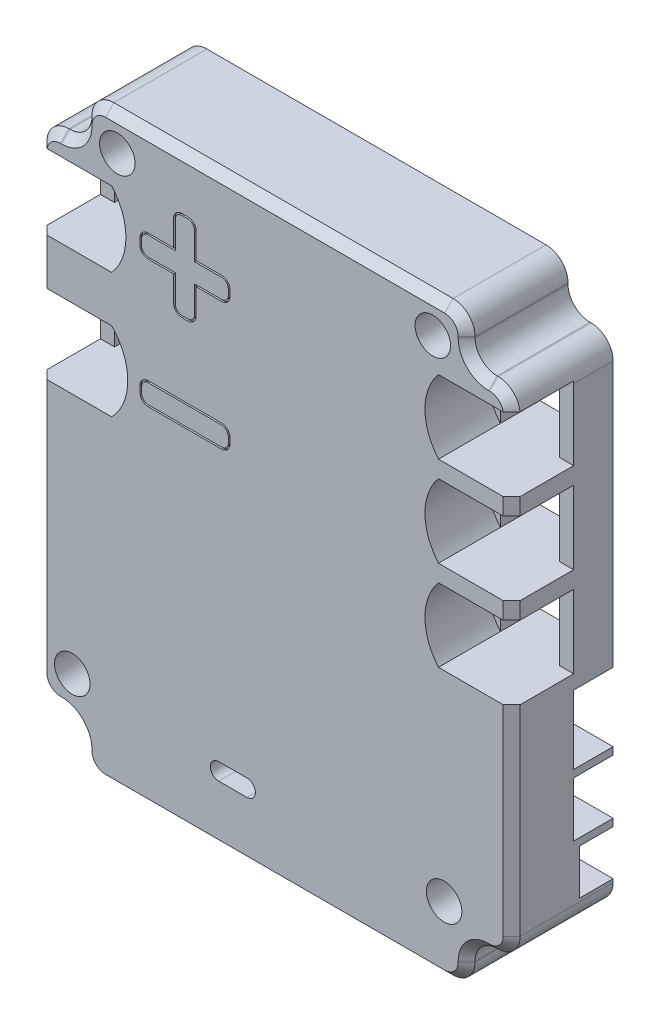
SolidWorks part; units mm, degrees
ref_plane "前视基准面" through (0, 0, 0) normal (0, 0, 1) x (1, 0, 0)
ref_plane "上视基准面" through (0, 0, 0) normal (0, 1, 0) x (1, 0, 0)
ref_plane "右视基准面" through (0, 0, 0) normal (1, 0, 0) x (0, 0, -1)
other "Configuration Table"
sketch "草图1" plane through (0, 0, 0) normal (0, 0, 1) x (1, 0, 0)
  line L0 (6, 1.9) -> (6, 2.1)
  line L1 (0, 0) -> (80, 0) construction
  line L2 (0, 0) -> (0, 100) construction
  line L3 (0, 100) -> (80, 100) construction
  line L4 (80, 0) -> (80, 100) construction
  line L5 (9.9, -2) -> (70.1, -2)
  line L6 (-2, 9.9) -> (-2, 90.1)
  line L7 (9.9, 102) -> (70.1, 102)
  line L8 (82, 9.9) -> (82, 90.1)
  line L9 (1.9, 94) -> (2.1, 94)
  line L10 (74, 1.9) -> (74, 2.1)
  line L11 (1.9, 6) -> (2.1, 6)
  line L12 (6, 94) -> (74, 94) construction
  line L13 (6, 6) -> (6, 94) construction
  line L14 (74, 6) -> (74, 94) construction
  line L15 (6, 6) -> (74, 6) construction
  line L16 (-2, 102) -> (82, 102) construction
  line L17 (-2, -2) -> (-2, 102) construction
  line L18 (77.9, 94) -> (78.1, 94)
  line L19 (6, 97.9) -> (6, 98.1)
  line L20 (82, -2) -> (82, 102) construction
  line L21 (-2, -2) -> (82, -2) construction
  line L22 (77.9, 6) -> (78.1, 6)
  line L23 (74, 97.9) -> (74, 98.1)
  arc A0 (-2, 9.9) -> (1.9, 6) centre (1.9, 9.9) ccw
  arc A1 (2.1, 6) -> (6, 2.1) centre (2.1, 2.1) cw
  arc A2 (6, 1.9) -> (9.9, -2) centre (9.9, 1.9) ccw
  arc A3 (70.1, -2) -> (74, 1.9) centre (70.1, 1.9) ccw
  arc A4 (74, 2.1) -> (77.9, 6) centre (77.9, 2.1) cw
  arc A5 (78.1, 6) -> (82, 9.9) centre (78.1, 9.9) ccw
  arc A6 (82, 90.1) -> (78.1, 94) centre (78.1, 90.1) ccw
  arc A7 (77.9, 94) -> (74, 97.9) centre (77.9, 97.9) cw
  arc A8 (74, 98.1) -> (70.1, 102) centre (70.1, 98.1) ccw
  arc A9 (-2, 90.1) -> (1.9, 94) centre (1.9, 90.1) cw
  arc A10 (2.1, 94) -> (6, 97.9) centre (2.1, 97.9) ccw
  arc A11 (6, 98.1) -> (9.9, 102) centre (9.9, 98.1) cw
  point P41 (74, 94)
  point P48 (6, 94)
  dimension "D8" = 3.9
  dimension "D1" = 100
  dimension "D2" = 80
  dimension "D3" = 2
  dimension "D4" = 2
  dimension "D5" = 2
  dimension "D6" = 2
  dimension "D7" = 8
extrude "凸台-拉伸1" add sketch "草图1" along normal blind 18
sketch "草图2" plane through (0, 0, 0) normal (0, 0, -1) x (-1, 0, 0)
  line L0 (-82, 9.9) -> (-82, 90.1) construction
  line L1 (-68.1, 100) -> (-11.9, 100)
  line L2 (-80, 88.1) -> (-80, 11.9)
  line L3 (-68.1, 0) -> (-11.9, 0)
  line L4 (0, 88.1) -> (0, 11.9)
  line L5 (2, 90.1) -> (2, 9.9) construction
  line L6 (-70.1, 102) -> (-9.9, 102) construction
  line L7 (-9.9, -2) -> (-70.1, -2) construction
  line L8 (-72, 96.1) -> (-72, 95.9)
  line L9 (-76.1, 8) -> (-75.9, 8)
  line L10 (-8, 96.1) -> (-8, 95.9)
  line L11 (-76.1, 92) -> (-75.9, 92)
  line L12 (-72, 92) -> (-8, 92) construction
  line L13 (-72, 92) -> (-72, 8) construction
  line L14 (-8, 92) -> (-8, 8) construction
  line L15 (-72, 8) -> (-8, 8) construction
  line L16 (-80, 100) -> (0, 100) construction
  line L17 (-80, 100) -> (-80, 0) construction
  line L18 (0, 100) -> (0, 0) construction
  line L19 (-80, 0) -> (0, 0) construction
  line L20 (-72, 4.1) -> (-72, 3.9)
  line L21 (-4.1, 92) -> (-3.9, 92)
  line L22 (-8, 4.1) -> (-8, 3.9)
  line L23 (-4.1, 8) -> (-3.9, 8)
  arc A0 (-80, 11.9) -> (-76.1, 8) centre (-76.1, 11.9) ccw
  arc A1 (-72, 4.1) -> (-75.9, 8) centre (-75.9, 4.1) ccw
  arc A2 (-72, 3.9) -> (-68.1, 0) centre (-68.1, 3.9) ccw
  arc A3 (-11.9, 0) -> (-8, 3.9) centre (-11.9, 3.9) ccw
  arc A4 (-8, 4.1) -> (-4.1, 8) centre (-4.1, 4.1) cw
  arc A5 (-3.9, 8) -> (0, 11.9) centre (-3.9, 11.9) ccw
  arc A6 (0, 88.1) -> (-3.9, 92) centre (-3.9, 88.1) ccw
  arc A7 (-4.1, 92) -> (-8, 95.9) centre (-4.1, 95.9) cw
  arc A8 (-8, 96.1) -> (-11.9, 100) centre (-11.9, 96.1) ccw
  arc A9 (-80, 88.1) -> (-76.1, 92) centre (-76.1, 88.1) cw
  arc A10 (-75.9, 92) -> (-72, 95.9) centre (-75.9, 95.9) ccw
  arc A11 (-72, 96.1) -> (-68.1, 100) centre (-68.1, 96.1) cw
  point P38 (-8, 8)
  dimension "D6" = 3.9
  dimension "D1" = 2
  dimension "D2" = 2
  dimension "D3" = 2
  dimension "D4" = 2
  dimension "D5" = 8
extrude "切除-拉伸1" cut sketch "草图2" against normal blind 16
sketch "草图6" plane through (0, 0, 0) normal (0, 0, -1) x (-1, 0, 0)
  line L0 (-80, 88.1) -> (-80, 11.9) construction
  line L1 (-80, 93.1) -> (-67, 93.1)
  line L2 (-80, 93.1) -> (-80, 7.435)
  line L3 (-80, 7.435) -> (-72.5, 7.435)
  line L4 (-67, 93.1) -> (-67, 14.316)
  line L5 (-70.1, 102) -> (-9.9, 102) construction
  line L8 (-67, 14.316) -> (-67, 7.435)
  line L9 (-67, 7.435) -> (-72.5, 7.435)
  dimension "D1" = 8.9
  dimension "D2" = 13
extrude "凸台-拉伸5" add sketch "草图6" against normal up to surface (16 mm away)
sketch "草图8" plane through (0, 0, 0) normal (0, 0, -1) x (-1, 0, 0)
  line L0 (-82, 9.9) -> (-82, 90.1) construction
  line L1 (-82, 90.5) -> (-69, 90.5)
  line L2 (-82, 90.5) -> (-82, 77.5)
  line L3 (-82, 77.5) -> (-69, 77.5)
  line L4 (-69, 90.5) -> (-69, 77.5)
  line L6 (-11.9, 100) -> (-68.1, 100) construction
  line L7 (-82, 74.5) -> (-69, 74.5)
  line L8 (-82, 74.5) -> (-82, 61.5)
  line L9 (-82, 61.5) -> (-69, 61.5)
  line L10 (-69, 74.5) -> (-69, 61.5)
  line L11 (-82, 58.5) -> (-69, 58.5)
  line L12 (-82, 58.5) -> (-82, 45.5)
  line L13 (-82, 45.5) -> (-69, 45.5)
  line L14 (-69, 58.5) -> (-69, 45.5)
  line L15 (-11.9, 100) -> (-68.1, 100) construction
  dimension "D1" = 9.5
  dimension "D2" = 13
  dimension "D3" = 25.5
  dimension "D4" = 13
  dimension "D5" = 41.5
  dimension "D6" = 13
  dimension "D7" = 13
  dimension "D8" = 13
  dimension "D9" = 13
extrude "切除-拉伸3" cut sketch "草图8" against normal through all
sketch "草图9" plane through (0, 0, 0) normal (0, 0, -1) x (-1, 0, 0)
  line L0 (-82, 9.9) -> (-82, 45.5) construction
  line L5 (-68.1, 0) -> (-11.9, 0) construction
  line L10 (-82, 18.5) -> (-73.5, 18.5)
  line L11 (-82, 18.5) -> (-82, 10.5)
  line L12 (-82, 10.5) -> (-73.5, 10.5)
  line L13 (-73.5, 18.5) -> (-73.5, 10.5)
  dimension "D1" = 10.5
  dimension "D2" = 18.5
  dimension "D3" = 8.5
extrude "切除-拉伸4" cut sketch "草图9" against normal blind 3.5
sketch "草图10" plane through (0, 0, 0) normal (0, 0, -1) x (-1, 0, 0)
  line L0 (-82, 18.5) -> (-82, 45.5) construction
  line L1 (-82, 43) -> (-75, 43)
  line L2 (-82, 43) -> (-82, 30.8)
  line L3 (-82, 30.8) -> (-75, 30.8)
  line L4 (-75, 43) -> (-75, 30.8)
  line L5 (-68.1, 0) -> (-11.9, 0) construction
  line L6 (-82, 29.5) -> (-75, 29.5)
  line L7 (-82, 29.5) -> (-82, 19.8)
  line L8 (-82, 19.8) -> (-75, 19.8)
  line L9 (-75, 29.5) -> (-75, 19.8)
  line L10 (-68.1, 0) -> (-11.9, 0) construction
  dimension "D1" = 19.8
  dimension "D2" = 29.5
  dimension "D3" = 7
  dimension "D4" = 30.8
  dimension "D5" = 43
  dimension "D6" = 7
extrude "切除-拉伸5" cut sketch "草图10" against normal blind 4.5
sketch "草图11" plane through (0, 0, 0) normal (0, 0, -1) x (-1, 0, 0)
  line L1 (-73, 22) -> (-64.6031, 22)
  line L4 (-64.6031, 22) -> (-64.6031, 30.5)
  line L5 (-68.1, 0) -> (-11.9, 0) construction
  line L7 (0, 11.9) -> (0, 88.1) construction
  line L14 (-70, 44.5) -> (-66.0552, 44.5)
  line L18 (-66.0552, 44.5) -> (-64.6031, 44.5)
  line L19 (-64.6031, 44.5) -> (-64.6031, 30.5)
  line L20 (-73, 41.5) -> (-73, 22)
  arc A0 (-70, 44.5) -> (-73, 41.5) centre (-70, 41.5) ccw
  dimension "D8" = 6
  dimension "D2" = 22
  dimension "D6" = 70
  dimension "D7" = 41.5
extrude "切除-拉伸6" cut sketch "草图11" against normal up to surface (16 mm away)
sketch "草图13" plane through (0, 0, 18) normal (0, 0, 1) x (1, 0, 0)
  line L0 (82, 45.5) -> (69, 45.5) construction
  line L1 (81.8544, 91.1556) -> (79.5, 91.1556)
  line L2 (82, 90.1) -> (82, 45.5)
  line L3 (82, 45.5) -> (79.5, 45.5)
  line L4 (79.5, 91.1556) -> (79.5, 45.5)
  arc A0 (82, 90.1) -> (81.8544, 91.1556) centre (78.1, 90.1) ccw
  dimension "D1" = 2.5
extrude "凸台-拉伸6" add sketch "草图13" against normal up to surface (18 mm away)
sketch "草图14" plane through (0, 0, 18) normal (0, 0, 1) x (1, 0, 0)
  line L0 (82, 9.9) -> (82, 90.1) construction
  line L1 (79.5, 90.5) -> (82, 90.5)
  line L2 (79.5, 90.5) -> (79.5, 77.5)
  line L3 (79.5, 77.5) -> (82, 77.5)
  line L4 (82, 90.5) -> (82, 77.5)
  line L6 (79.5, 74.5) -> (82, 74.5)
  line L7 (79.5, 74.5) -> (79.5, 61.5)
  line L8 (79.5, 61.5) -> (82, 61.5)
  line L9 (82, 74.5) -> (82, 61.5)
  line L10 (79.5, 58.5) -> (82, 58.5)
  line L11 (79.5, 58.5) -> (79.5, 45.5)
  line L12 (79.5, 45.5) -> (82, 45.5)
  line L13 (82, 58.5) -> (82, 45.5)
  dimension "D1" = 13
  dimension "D2" = 13
  dimension "D3" = 13
extrude "切除-拉伸8" cut sketch "草图14" against normal blind 11
sketch "草图16" plane through (0, 0, 0) normal (0, 0, -1) x (-1, 0, 0)
  line L0 (0, 11.9) -> (0, 88.1) construction
  line L2 (-16.5, 93.2144) -> (-16.5, 14.2455)
  line L3 (-16.5, 14.2455) -> (0, 14.2455)
  line L4 (0, 93.2144) -> (0, 14.2455)
  line L5 (2, 90.1) -> (2, 9.9) construction
  line L8 (0, 93.2144) -> (-16.5, 93.2144)
  dimension "D1" = 18.5
extrude "凸台-拉伸7" add sketch "草图16" against normal up to surface (16 mm away)
sketch "草图17" plane through (0, 0, 0) normal (0, 0, -1) x (-1, 0, 0)
  line L0 (-11.9, 100) -> (-68.1, 100) construction
  line L1 (-0.5, 90.5) -> (-11, 90.5)
  line L2 (-0.5, 90.5) -> (-0.5, 77.2)
  line L3 (-0.5, 77.2) -> (-11, 77.2)
  line L4 (-11, 90.5) -> (-11, 77.2)
  line L5 (-0.5, 69) -> (-11, 69)
  line L6 (-0.5, 69) -> (-0.5, 55)
  line L7 (-0.5, 55) -> (-11, 55)
  line L8 (-11, 69) -> (-11, 55)
  line L9 (-11.9, 100) -> (-68.1, 100) construction
  line L10 (2, 90.1) -> (2, 9.9) construction
  dimension "D1" = 9.5
  dimension "D2" = 22.8
  dimension "D3" = 2.5
  dimension "D4" = 10.5
  dimension "D5" = 2.5
  dimension "D6" = 10.5
  dimension "D7" = 31
  dimension "D8" = 45
extrude "切除-拉伸9" cut sketch "草图17" against normal through all
sketch "草图18" plane through (0, 0, 18) normal (0, 0, 1) x (1, 0, 0)
  line L0 (-2, 90.1) -> (-2, 9.9) construction
  line L1 (0.5, 90.5) -> (-2, 90.5)
  line L2 (0.5, 90.5) -> (0.5, 77.2)
  line L3 (0.5, 77.2) -> (-2, 77.2)
  line L4 (-2, 90.5) -> (-2, 77.2)
  line L5 (0.5, 55) -> (0.5, 69) construction
  line L6 (0.5, 69) -> (-2, 69)
  line L7 (0.5, 69) -> (0.5, 55)
  line L8 (0.5, 55) -> (-2, 55)
  line L9 (-2, 69) -> (-2, 55)
  dimension "D1" = 13.3
  dimension "D2" = 14
extrude "切除-拉伸10" cut sketch "草图18" against normal up to surface (11 mm away)
sketch "草图22" plane through (0, 0, 0) normal (0, 0, -1) x (-1, 0, 0)
  line L0 (2, 90.1) -> (2, 9.9) construction
  line L1 (2, 49) -> (-16.5, 49)
  line L2 (2, 49) -> (2, 32.3)
  line L3 (2, 32.3) -> (-16.5, 32.3)
  line L4 (-16.5, 49) -> (-16.5, 32.3)
  line L7 (2, 31) -> (-16.5, 31)
  line L8 (2, 31) -> (2, 14.2455)
  line L9 (2, 14.2455) -> (-16.5, 14.2455)
  line L10 (-16.5, 31) -> (-16.5, 14.2455)
  line L11 (-68.1, 0) -> (-11.9, 0) construction
  line L12 (-68.1, 0) -> (-11.9, 0) construction
  dimension "D2" = 31
  dimension "D3" = 32.3
  dimension "D4" = 49
extrude "切除-拉伸16" cut sketch "草图22" against normal blind 8.7
sketch "草图23" plane through (0, 0, 0) normal (0, 0, -1) x (-1, 0, 0)
  line L4 (-73.9847, 6.0466) -> (-70.3945, -0.8347)
  line L5 (-70.3945, -0.8347) -> (-68.9263, -1.64)
  line L6 (-68.9263, -1.64) -> (-8.8752, -1.64)
  line L7 (-8.8752, -1.64) -> (-7.5895, 0.704)
  line L8 (-7.5895, 0.704) -> (-6.1243, 3.3751)
  line L19 (-16.5, 7) -> (-65.5, 7)
  line L20 (-9.9, -2) -> (-70.1, -2) construction
  line L21 (-16.5, 7) -> (-16.5, 14.2455)
  line L26 (-16.5, 14.2455) -> (-6.8189, 14.2455)
  line L27 (-73.9847, 7.347) -> (-73.9847, 6.0466)
  line L29 (-73.9847, 7.347) -> (-73.9742, 7.3333)
  line L30 (-73.9742, 7.3333) -> (-72.4075, 11.5635)
  line L31 (-72.4075, 11.5635) -> (-70.51, 14.5577)
  line L33 (0, 14.2455) -> (-16.5, 14.2455) construction
  line L34 (-6.8189, 14.2455) -> (1.2926, 14.2455)
  line L35 (1.2926, 14.2455) -> (1.2926, 11.043)
  line L36 (1.2926, 11.043) -> (-0.5888, 7.5907)
  line L37 (-0.5888, 7.5907) -> (-4.9543, 6.1112)
  line L38 (-4.9543, 6.1112) -> (-6.1243, 3.3751)
  line L40 (-70.51, 14.5577) -> (-67, 22)
  line L41 (-67, 22) -> (-65.5, 22)
  line L42 (-65.5, 22) -> (-65.5, 7)
  dimension "D1" = 9
  dimension "D2" = 1.5
extrude "凸台-拉伸8" add sketch "草图23" against normal up to surface (16 mm away)
sketch "草图24" plane through (0, 0, 0) normal (0, 0, -1) x (-1, 0, 0)
  line L0 (-9.9, -2) -> (-70.1, -2) construction
  line L1 (-69.5, -2) -> (-10.5, -2)
  line L2 (-69.5, -2) -> (-69.5, 5.5)
  line L3 (-69.5, 5.5) -> (-10.5, 5.5)
  line L4 (-10.5, -2) -> (-10.5, 5.5)
  line L5 (2, 14.2455) -> (2, 9.9) construction
  line L6 (-82, 18.5) -> (-82, 10.5) construction
  dimension "D1" = 7.5
  dimension "D2" = 12.5
  dimension "D3" = 12.5
extrude "切除-拉伸17" cut sketch "草图24" against normal blind 4.5
sketch "草图25" plane through (0, 0, 0) normal (0, 0, -1) x (-1, 0, 0)
  line L0 (-69.5, -2) -> (-10.5, -2) construction
  line L1 (-29.6, 8.2) -> (-20.4, 8.2)
  line L2 (-29.6, 8.2) -> (-29.6, -2)
  line L3 (-29.6, -2) -> (-20.4, -2)
  line L4 (-20.4, 8.2) -> (-20.4, -2)
  dimension "D1" = 10.2
  dimension "D2" = 20.4
  dimension "D3" = 9.2
extrude "切除-拉伸18" cut sketch "草图25" against normal blind 3
sketch "草图26" plane through (0, 0, 0) normal (0, 0, -1) x (-1, 0, 0)
  line L1 (-20.9012, 15.117) -> (-10.6829, 15.117)
  line L2 (-20.9012, 15.117) -> (-20.9012, 6.1419)
  line L3 (-20.9012, 6.1419) -> (-10.6829, 6.1419)
  line L4 (-10.6829, 15.117) -> (-10.6829, 6.1419)
extrude "切除-拉伸19" cut sketch "草图26" against normal up to surface (3 mm away)
sketch "草图30" plane through (0, 0, 18) normal (0, 0, 1) x (1, 0, 0)
  line L0 (30, 10) -> (35, 10) construction
  line L1 (30, 11.5) -> (35, 11.5)
  line L2 (30, 8.5) -> (35, 8.5)
  line L3 (-2, 55) -> (-2, 9.9) construction
  line L4 (9.9, -2) -> (70.1, -2) construction
  arc A0 (30, 11.5) -> (30, 8.5) centre (30, 10) ccw
  arc A1 (35, 8.5) -> (35, 11.5) centre (35, 10) ccw
  point P2 (32.5, 10)
  dimension "D1" = 32
  dimension "D2" = 5
  dimension "D3" = 3
  dimension "D4" = 12
extrude "切除-拉伸21" cut sketch "草图30" against normal up to surface (2 mm away)
fillet "圆角1" radius 2.5 2 edges at (6.928, 93.2144, 8) (73.1852, 93.1, 8)
sketch "草图37" plane through (0, 0, 0) normal (0, 0, -1) x (-1, 0, 0)
  line L0 (2, 49) -> (-16.5, 49) construction
  line L1 (-16.5, 93.2144) -> (-12.5, 93.2144)
  line L2 (-16.5, 93.2144) -> (-16.5, 49)
  line L3 (-16.5, 49) -> (-11, 49)
  line L4 (-12.5, 93.2144) -> (-12.5, 76.2)
  line L5 (-11, 90.5) -> (-11, 77.2) construction
  line L6 (-11, 77.2) -> (-0.5, 77.2) construction
  line L7 (-12.5, 76.2) -> (0, 76.2)
  line L9 (-12.5, 70) -> (0, 70)
  line L10 (0, 76.2) -> (0, 70)
  line L11 (-0.5, 69) -> (-11, 69) construction
  line L12 (-11, 55) -> (-0.5, 55) construction
  line L13 (-11, 49) -> (0, 49)
  line L15 (-12.5, 54) -> (0, 54)
  line L16 (0, 49) -> (0, 54)
  line L17 (2, 90.1) -> (2, 49) construction
  line L18 (-12.5, 70) -> (-12.5, 54)
  dimension "D1" = 1.5
  dimension "D2" = 1
  dimension "D3" = 1
  dimension "D4" = 2
  dimension "D5" = 1
  dimension "D6" = 2
extrude "切除-拉伸27" cut sketch "草图37" against normal up to surface (8.7 mm away)
sketch "草图43" plane through (0, 0, 0) normal (0, 0, -1) x (-1, 0, 0)
  line L0 (0, 54) -> (-12.5, 54) construction
  line L1 (-65.3531, 94.8255) -> (-69, 94.8255)
  line L2 (-65.3531, 94.8255) -> (-65.3531, 43.8321)
  line L3 (-65.3531, 43.8321) -> (-69, 43.8321)
  line L4 (-69, 94.8255) -> (-69, 43.8321)
  line L5 (-12.5, 93.2144) -> (-11, 93.2144)
  line L6 (-12.5, 93.2144) -> (-12.5, 54)
  line L7 (-12.5, 54) -> (-11, 54)
  line L8 (-11, 93.2144) -> (-11, 54)
extrude "切除-拉伸31" cut sketch "草图43" against normal blind 2
sketch "草图44" plane through (0, 0, 16) normal (0, 0, -1) x (-1, 0, 0)
  line L0 (-34, 92) -> (-34, 58) construction
  line L1 (-26.5, 92) -> (-26.5, 58)
  line L2 (-41.5, 92) -> (-41.5, 58)
  line L5 (-70.1, 102) -> (-9.9, 102) construction
  line L6 (2, 90.1) -> (2, 49) construction
  arc A0 (-26.5, 92) -> (-41.5, 92) centre (-34, 92) ccw
  arc A1 (-41.5, 58) -> (-26.5, 58) centre (-34, 58) ccw
  point P2 (-34, 75)
  dimension "D4" = 7.5
  dimension "D1" = 36
  dimension "D2" = 10
  dimension "D3" = 34
extrude "切除-拉伸32" cut sketch "草图44" against normal blind 1
chamfer "倒角2" distance 1.5 angle 45 27 edges at (82, 27.7, 18) (80.8577, 7.1423, 18) (78, 6, 18) (75.1423, 4.8577, 18) (74, 2, 18) (72.8577, -0.8577, 18) (40, -2, 18) (7.1423, -0.8577, 18) (6, 2, 18) (4.8577, 4.8577, 18) (2, 6, 18) (-0.8577, 7.1423, 18) (-2, 32.45, 18) (-2, 73.1, 18) (-0.7125, 92.9957, 18) (2, 94, 18) (4.8577, 95.1423, 18) (6, 98, 18) (7.1423, 100.8577, 18) (40, 102, 18) (72.8577, 100.8577, 18) (74, 98, 18) (75.1423, 95.1423, 18) (78, 94, 18) (80.7125, 92.9957, 18) (82, 60, 18) (82, 76, 18)
sketch "草图45" plane through (0, 0, 18) normal (0, 0, 1) x (1, 0, 0)
  line L0 (-2, 77.2) -> (-2, 90.1) construction
  line L1 (17.5, 86.5) -> (22, 86.5)
  line L2 (16, 85) -> (16, 84)
  line L3 (17.5, 82.5) -> (22, 82.5)
  line L4 (32, 85) -> (32, 84)
  line L5 (23.5, 92.5) -> (24.5, 92.5)
  line L6 (22, 91) -> (22, 86.5)
  line L7 (23.5, 76.5) -> (24.5, 76.5)
  line L8 (26, 91) -> (26, 86.5)
  line L9 (9.9, 102) -> (70.1, 102) construction
  line L10 (26, 86.5) -> (30.5, 86.5)
  line L11 (22, 82.5) -> (22, 78)
  line L12 (26, 82.5) -> (26, 78)
  line L13 (26, 82.5) -> (30.5, 82.5)
  line L14 (-2, 55) -> (-2, 69) construction
  line L15 (17.5, 63.8) -> (30.5, 63.8)
  line L16 (16, 62.3) -> (16, 61.3)
  line L17 (17.5, 59.8) -> (30.5, 59.8)
  line L18 (32, 62.3) -> (32, 61.3)
  line L19 (22.3, 91) -> (22.3, 86.2)
  line L20 (17.5, 86.2) -> (22.3, 86.2)
  line L21 (16.3, 85) -> (16.3, 84)
  line L22 (17.5, 82.8) -> (22.3, 82.8)
  line L23 (22.3, 82.8) -> (22.3, 78)
  line L24 (23.5, 76.8) -> (24.5, 76.8)
  line L25 (25.7, 82.8) -> (25.7, 78)
  line L26 (25.7, 82.8) -> (30.5, 82.8)
  line L27 (31.7, 85) -> (31.7, 84)
  line L28 (25.7, 86.2) -> (30.5, 86.2)
  line L29 (25.7, 91) -> (25.7, 86.2)
  line L30 (23.5, 92.2) -> (24.5, 92.2)
  line L31 (17.5, 63.5) -> (30.5, 63.5)
  line L32 (31.7, 62.3) -> (31.7, 61.3)
  line L33 (17.5, 60.1) -> (30.5, 60.1)
  line L34 (16.3, 62.3) -> (16.3, 61.3)
  arc A0 (30.5, 63.8) -> (32, 62.3) centre (30.5, 62.3) cw
  arc A1 (32, 61.3) -> (30.5, 59.8) centre (30.5, 61.3) cw
  arc A2 (17.5, 59.8) -> (16, 61.3) centre (17.5, 61.3) cw
  arc A3 (16, 62.3) -> (17.5, 63.8) centre (17.5, 62.3) cw
  arc A4 (17.5, 86.5) -> (16, 85) centre (17.5, 85) ccw
  arc A5 (16, 84) -> (17.5, 82.5) centre (17.5, 84) ccw
  arc A6 (23.5, 76.5) -> (22, 78) centre (23.5, 78) cw
  arc A7 (24.5, 76.5) -> (26, 78) centre (24.5, 78) ccw
  arc A8 (30.5, 82.5) -> (32, 84) centre (30.5, 84) ccw
  arc A9 (32, 85) -> (30.5, 86.5) centre (30.5, 85) ccw
  arc A10 (26, 91) -> (24.5, 92.5) centre (24.5, 91) ccw
  arc A11 (22, 91) -> (23.5, 92.5) centre (23.5, 91) cw
  arc A12 (17.5, 86.2) -> (16.3, 85) centre (17.5, 85) ccw
  arc A13 (16.3, 84) -> (17.5, 82.8) centre (17.5, 84) ccw
  arc A14 (23.5, 76.8) -> (22.3, 78) centre (23.5, 78) cw
  arc A15 (24.5, 76.8) -> (25.7, 78) centre (24.5, 78) ccw
  arc A16 (30.5, 82.8) -> (31.7, 84) centre (30.5, 84) ccw
  arc A17 (31.7, 85) -> (30.5, 86.2) centre (30.5, 85) ccw
  arc A18 (25.7, 91) -> (24.5, 92.2) centre (24.5, 91) ccw
  arc A19 (22.3, 91) -> (23.5, 92.2) centre (23.5, 91) cw
  arc A20 (30.5, 63.5) -> (31.7, 62.3) centre (30.5, 62.3) cw
  arc A21 (31.7, 61.3) -> (30.5, 60.1) centre (30.5, 61.3) cw
  arc A22 (17.5, 60.1) -> (16.3, 61.3) centre (17.5, 61.3) cw
  arc A23 (16.3, 62.3) -> (17.5, 63.5) centre (17.5, 62.3) cw
  point P24 (32, 63.8)
  point P27 (32, 59.8)
  point P32 (16, 63.8)
  point P35 (16, 86.5)
  point P42 (26, 76.5)
  point P45 (32, 82.5)
  point P48 (32, 86.5)
  point P51 (26, 92.5)
  point P54 (22, 92.5)
  dimension "D13" = 1.5
  dimension "D1" = 16
  dimension "D2" = 4
  dimension "D3" = 4
  dimension "D4" = 16
  dimension "D5" = 18
  dimension "D6" = 6
  dimension "D7" = 6
  dimension "D8" = 9.5
  dimension "D9" = 16
  dimension "D10" = 4
  dimension "D11" = 38.2
  dimension "D12" = 18
  dimension "D14" = 0.3
sketch "草图48" plane through (0, 0, 16) normal (0, 0, -1) x (-1, 0, 0)
  line L0 (-64.5, 100) -> (-64.5, 93.1)
  line L1 (-11.9, 100) -> (-68.1, 100) construction
  line L2 (-82, 43) -> (-82, 90.1) construction
  line L4 (-64.5, 100) -> (-68.1, 100)
  line L5 (-15.5, 100) -> (-15.5, 93.4252)
  line L6 (-11.9, 100) -> (-68.1, 100) construction
  line L8 (2, 90.1) -> (2, 49) construction
  line L9 (-15.5, 100) -> (-11.9, 100)
  line L10 (-69.507, 93.1) -> (-69.507, 92.1)
  line L11 (-69.507, 92.1) -> (-64.5, 92.1)
  line L12 (-64.5, 92.1) -> (-64.5, 93.1)
  line L13 (-15.5, 93.4252) -> (-15.5, 92.4252)
  line L14 (-15.5, 92.4252) -> (-10.4973, 92.4252)
  line L15 (-10.4973, 92.4252) -> (-10.4973, 93.2144)
  arc A0 (-68.1, 100) -> (-71.9929, 95.8652) centre (-68.1, 96.1) ccw
  arc A1 (-71.9929, 95.8652) -> (-69.507, 93.1) centre (-69.507, 95.6) ccw
  arc A3 (-10.4973, 93.2144) -> (-8.0048, 95.9073) centre (-10.4973, 95.7144) ccw
  arc A4 (-8.0048, 95.9073) -> (-11.9, 100) centre (-11.9, 96.1) ccw
  dimension "D1" = 17.5
  dimension "D2" = 17.5
  dimension "D3" = 1
  dimension "D4" = 1
extrude "凸台-拉伸9" add sketch "草图48" along normal up to surface (16 mm away)
sketch "草图49" plane through (0, 0, 8.7) normal (0, 0, -1) x (-1, 0, 0)
  line L3 (-1, 14.2455) -> (-10.6829, 14.2455)
  line L4 (-1, 14.2455) -> (-1, 9)
  line L5 (-1, 9) -> (-10.6829, 9)
  line L6 (-10.6829, 14.2455) -> (-10.6829, 9)
extrude "凸台-拉伸10" add sketch "草图49" along normal up to surface (8.7 mm away)
sketch "草图52" plane through (0, 0, 18) normal (0, 0, 1) x (1, 0, 0)
  line L0 (-2, 77.2) -> (-2, 90.1) construction
  line L1 (82, 77.5) -> (82, 90.1) construction
  line L2 (9.9, 102) -> (70.1, 102) construction
  line L3 (82, 45.5) -> (82, 9.9) construction
  line L4 (70.1, -2) -> (9.9, -2) construction
  line L5 (-2, 9.9) -> (-2, 55) construction
  circle A0 centre (12, 96) radius 3.15
  circle A1 centre (68, 96) radius 3.15
  circle A2 centre (70, 10) radius 3.15
  circle A3 centre (4, 12) radius 3.15
  dimension "D5" = 6.3
  dimension "D6" = 6.3
  dimension "D7" = 6.3
  dimension "D12" = 6.3
  dimension "D1" = 14
  dimension "D2" = 14
  dimension "D3" = 6
  dimension "D4" = 6
  dimension "D8" = 12
  dimension "D9" = 12
  dimension "D10" = 6
  dimension "D11" = 14
extrude "切除-拉伸34" cut sketch "草图52" against normal blind 16
sketch "草图54" plane through (0, 0, 2) normal (0, 0, 1) x (1, 0, 0)
  circle A0 centre (12, 96) radius 1.8
  circle A1 centre (68, 96) radius 1.8
  circle A2 centre (70, 10) radius 1.8
  circle A3 centre (4, 12) radius 1.8
  dimension "D1" = 3.6
  dimension "D2" = 3.6
  dimension "D3" = 3.6
  dimension "D4" = 3.6
extrude "切除-拉伸35" cut sketch "草图54" against normal through all
chamfer "倒角4" distance 1.2 angle 45 4 edges at (4, 8.85, 2) (73.15, 10, 2) (71.15, 96, 2) (15.15, 96, 2)
chamfer "倒角5" distance 2.5 angle 45 4 edges at (40, -2, 4.5) (82, 36.9, 4.5) (82, 24.65, 4.5) (82, 14.5, 3.5)
sketch "草图55" plane through (0, 0, 0) normal (0, 0, -1) x (-1, 0, 0)
  line L0 (2, 31) -> (-16.5, 31) construction
  line L1 (-16.5, 32.3) -> (-13.5, 32.3)
  line L2 (-16.5, 32.3) -> (-16.5, 31)
  line L3 (-16.5, 31) -> (-13.5, 31)
  line L4 (-13.5, 32.3) -> (-13.5, 31)
  dimension "D1" = 3
extrude "切除-拉伸36" cut sketch "草图55" against normal up to surface (8.7 mm away)
extrude "切除-拉伸37" cut sketch "草图45" against normal blind 0.3
sketch "草图58" plane through (0, 0, 8.7) normal (0, 0, -1) x (-1, 0, 0)
  line L0 (0, 54) -> (-12.5, 54) construction
  line L1 (-15.5, 92.4252) -> (-12.5, 92.4252)
  line L3 (-15.5, 54) -> (-12.5, 54)
  line L4 (-12.5, 92.4252) -> (-12.5, 54)
  line L5 (-12.5, 70) -> (-12.5, 54) construction
  line L7 (-16.5, 93.2144) -> (-15.5, 93.2144)
  line L8 (-16.5, 93.2144) -> (-16.5, 54)
  line L9 (-16.5, 54) -> (-15.5, 54)
  line L10 (-15.5, 93.2144) -> (-15.5, 92.4252)
extrude "凸台-拉伸11" add sketch "草图58" along normal blind 3
sketch "草图59" plane through (0, 0, 16) normal (0, 0, -1) x (-1, 0, 0)
  line L1 (-64.5, 92.1) -> (-67, 92.1)
  line L2 (-64.5, 92.1) -> (-64.5, 44.5)
  line L3 (-64.5, 44.5) -> (-67, 44.5)
  line L4 (-67, 92.1) -> (-67, 44.5)
extrude "凸台-拉伸12" add sketch "草图59" along normal up to surface (10.3 mm away)
sketch "草图57" plane through (0, 0, 18) normal (0, 0, 1) x (1, 0, 0)
  line L0 (11, 90.5) -> (11, 77.2)
  line L1 (11, 69) -> (11, 55)
  line L2 (69, 90.5) -> (69, 77.5)
  line L3 (69, 74.5) -> (69, 61.5)
  line L4 (69, 58.5) -> (69, 45.5)
  arc A0 (11, 77.2) -> (11, 90.5) centre (3.5316, 83.85) ccw
  arc A1 (11, 55) -> (11, 69) centre (3.8586, 62) ccw
  arc A2 (69, 90.5) -> (69, 77.5) centre (76.5993, 84) ccw
  arc A4 (69, 58.5) -> (69, 45.5) centre (76.5993, 52) ccw
  arc A6 (69, 74.5) -> (69, 61.5) centre (76.5993, 68) ccw
  dimension "D1" = 20
  dimension "D2" = 20
  dimension "D4" = 20
  dimension "D5" = 20
extrude "切除-拉伸38" cut sketch "草图57" against normal up to surface (11 mm away)
sketch "草图60" plane through (0, 0, 16) normal (0, 0, -1) x (-1, 0, 0)
  line L0 (-35, 10) -> (-30, 10) construction
  line L1 (-35, 11.5) -> (-30, 11.5)
  line L2 (-35, 8.5) -> (-30, 8.5)
  line L13 (-35, 12.5) -> (-30, 12.5)
  line L14 (-35, 7.5) -> (-30, 7.5)
  arc A0 (-35, 11.5) -> (-35, 8.5) centre (-35, 10) ccw
  arc A1 (-30, 8.5) -> (-30, 11.5) centre (-30, 10) ccw
  arc A3 (-30, 7.5) -> (-30, 12.5) centre (-30, 10) ccw
  arc A4 (-35, 12.5) -> (-35, 7.5) centre (-35, 10) ccw
  point P4 (-32.5, 10)
  dimension "D1" = 1.5
  dimension "D2" = 1
extrude "凸台-拉伸13" add sketch "草图60" along normal up to surface (13 mm away)
